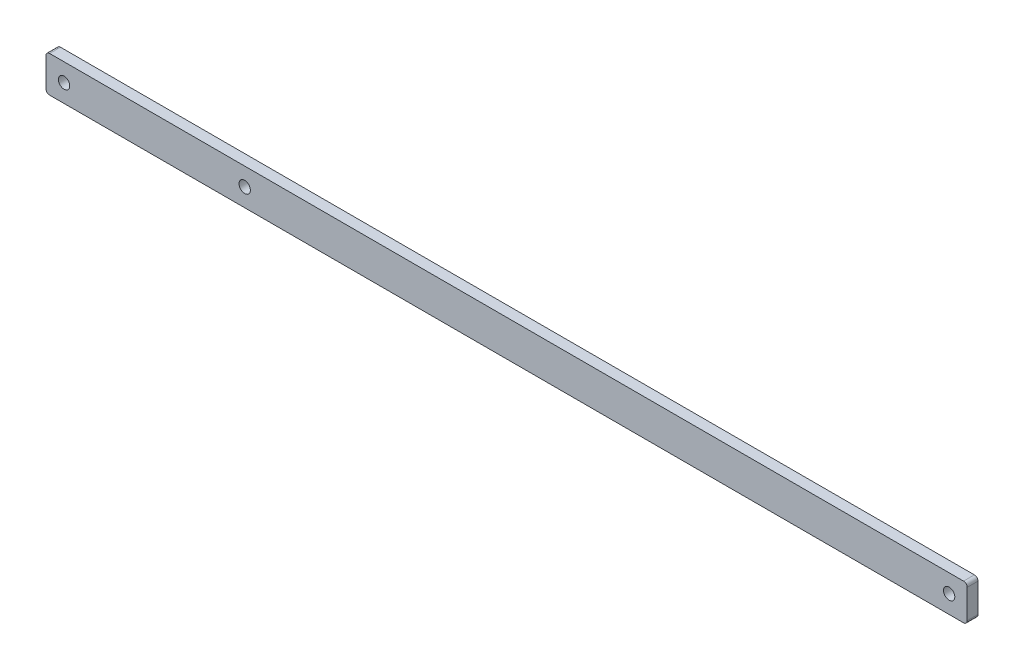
SolidWorks part; units mm, degrees
ref_plane "Front Plane" through (0, 0, 0) normal (0, 0, 1) x (1, 0, 0)
ref_plane "Top Plane" through (0, 0, 0) normal (0, 1, 0) x (1, 0, 0)
ref_plane "Right Plane" through (0, 0, 0) normal (1, 0, 0) x (0, 0, -1)
sketch "Sketch1" plane through (0, 0, 0) normal (0, 0, 1) x (1, 0, 0)
  line L1 (0, 0) -> (647.7, 0)
  line L2 (0, 0) -> (0, 25.4)
  line L3 (0, 25.4) -> (647.7, 25.4)
  line L4 (647.7, 0) -> (647.7, 25.4)
  dimension "D1" = 25.4
  dimension "D2" = 647.7
extrude "Boss-Extrude1" add sketch "Sketch1" along normal blind 7.62
sketch "Sketch2" plane through (0, 0, 7.62) normal (0, 0, 1) x (1, 0, 0)
  line L0 (647.7, 12.7) -> (0, 12.7) construction
  line L1 (647.7, 0) -> (647.7, 25.4) construction
  line L2 (0, 25.4) -> (0, 0) construction
  circle A0 centre (12.7, 12.7) radius 4
  dimension "D1" = 8
  dimension "D2" = 12.7
extrude "Cut-Extrude1" cut sketch "Sketch2" against normal through all
ref_plane "Plane1" through (323.85, 0, 0) normal (1, 0, 0) x (0, 0, -1)
mirror "Mirror1" about plane through (323.85, 0, 0) normal (1, 0, 0) of "Cut-Extrude1"
fillet "Fillet1" radius 2.54 4 edges at (0, 25.4, 3.81) (0, 0, 3.81) (647.7, 0, 3.81) (647.7, 25.4, 3.81)
sketch "Sketch3" plane through (0, 0, 7.62) normal (0, 0, 1) x (1, 0, 0)
  line L0 (139.7, 25.4) -> (139.7, 0) construction
  line L1 (0, 12.7) -> (647.7, 12.7) construction
  line L2 (0, 22.86) -> (0, 2.54) construction
  line L3 (647.7, 2.54) -> (647.7, 22.86) construction
  line L4 (645.16, 25.4) -> (2.54, 25.4) construction
  line L5 (2.54, 0) -> (645.16, 0) construction
  circle A0 centre (139.7, 12.7) radius 4
  circle A1 centre (12.7, 12.7) radius 4 construction
  point P10 (88.9, 12.7)
  point P11 (647.7, 12.7)
  point P14 (88.9, 25.4)
  point P17 (88.9, 0)
  point P20 (88.9, 12.4866)
  point P21 (88.9, 14.3557)
  dimension "D1" = 127
extrude "Cut-Extrude2" cut sketch "Sketch3" against normal through all
